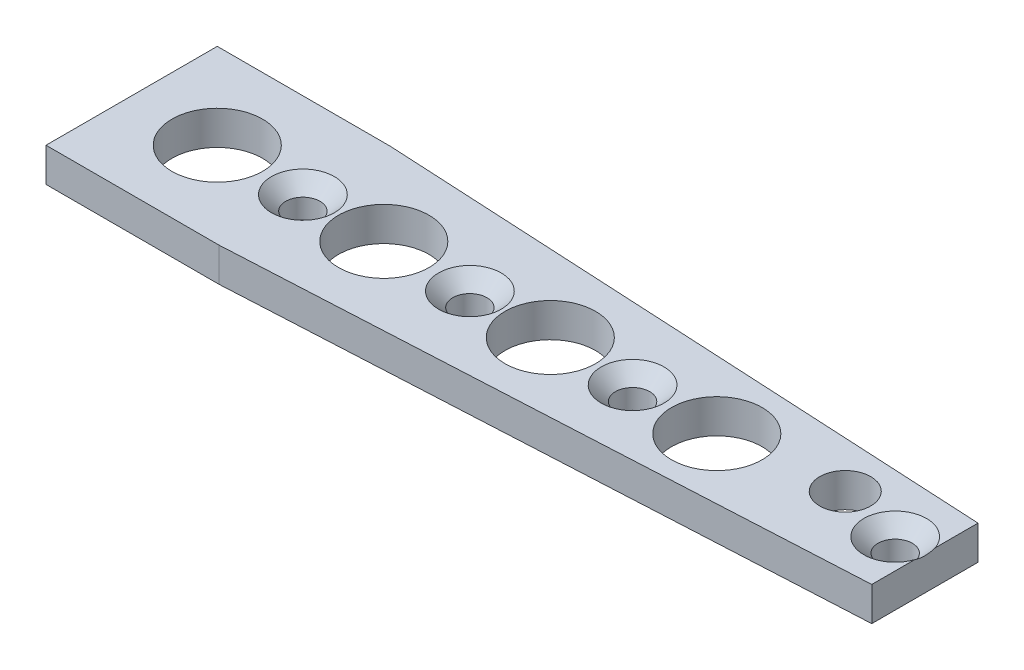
SolidWorks part; units mm, degrees
ref_plane "Front Plane" through (0, 0, 0) normal (0, 0, 1) x (1, 0, 0)
ref_plane "Top Plane" through (0, 0, 0) normal (0, 1, 0) x (1, 0, 0)
ref_plane "Right Plane" through (0, 0, 0) normal (1, 0, 0) x (0, 0, -1)
sketch "Sketch1" plane through (0, 0, 0) normal (0, 1, 0) x (1, 0, 0)
  line L0 (55.58, 3.7222) -> (0, 6.635)
  line L1 (0, 6.635) -> (0, -6.635)
  line L2 (0, -6.635) -> (55.58, -3.7222)
  line L3 (55.58, 3.7222) -> (55.58, -3.7222)
  line L7 (0, -1.309) -> (0, 1.309) construction
  line L8 (-1.309, 0) -> (1.309, 0) construction
  circle A5 centre (12, 0) radius 0.8 construction
  circle A6 centre (23.7, 0) radius 0.8 construction
  circle A7 centre (35.1, 0) radius 0.8 construction
  circle A8 centre (53.5, 0) radius 0.8 construction
  arc A9 (37.8113, 0.796) -> (37.8113, -0.796) centre (37.7313, 0) ccw construction
  point P30 (0, 0)
  point P31 (55.58, 0)
  dimension "D7" = 37.7313
  dimension "D6" = 1.6
  dimension "D2" = 12
  dimension "D3" = 23.7
  dimension "D4" = 35.1
  dimension "D5" = 53.5
  dimension "D9" = 6
  dimension "D10" = 55.58
  dimension "D11" = 13.27
extrude "Boss-Extrude1" add sketch "Sketch1" along normal blind 2.38
hole_wizard "1/4 (0.25) Diameter Hole1" positions "Sketch3" profile "Sketch4" hole size "1/4" standard "ANSI Inch"
sketch "Sketch3" plane through (0, 2.38, 0) normal (0, 1, 0) x (1, 0, 0)
  line L0 (0, -1.309) -> (0, 1.309) construction
  line L1 (-1.309, 0) -> (1.309, 0) construction
  point P0 (6, 0)
  dimension "D1" = 6
sketch "Sketch4" plane through (6, 2.38, 0) normal (1, 0, 0) x (0, 0, 1)
  line L0 (0, 0) -> (0, 2.38)
  line L1 (0, 2.38) -> (3.175, 2.38)
  line L2 (3.175, 2.38) -> (3.175, 0)
  line L5 (3.175, 0) -> (0, 0)
  line L11 (0, -6.35) -> (0, 107.95) construction
  dimension "Thru Hole Dia." = 6.35
  dimension "Thru Hole Depth" = 2.38
pattern_linear "LPattern1" count 4 spacing 11.667 along (1, 0, 0) of "1/4 (0.25) Diameter Hole1"
hole_wizard "9/64 (0.14063) Diameter Hole1" positions "Sketch6" profile "Sketch5" hole size "9/64" standard "ANSI Inch"
sketch "Sketch6" plane through (0, 2.38, 0) normal (0, 1, 0) x (1, 0, 0)
  line L0 (0, -1.309) -> (0, 1.309) construction
  line L1 (-1.309, 0) -> (1.309, 0) construction
  point P0 (49, 1)
  dimension "D1" = 49
  dimension "D2" = 1
sketch "Sketch5" plane through (49, 2.38, -1) normal (1, 0, 0) x (0, 0, 1)
  line L0 (0, 0) -> (0, 2.38)
  line L1 (0, 2.38) -> (1.786, 2.38)
  line L2 (1.786, 2.38) -> (1.786, 0)
  line L5 (1.786, 0) -> (0, 0)
  line L11 (0, -6.35) -> (0, 107.95) construction
  dimension "Thru Hole Dia." = 3.572
  dimension "Thru Hole Depth" = 2.38
hole_wizard "CSK for M2 Flat Head Machine Screw1" positions "Sketch8" profile "Sketch9" countersink size "M2" standard "ANSI Metric"
sketch "Sketch8" plane through (0, 2.38, 0) normal (0, 1, 0) x (1, 0, 0)
  point P0 (12, 0)
  point P3 (23.7, 0)
  point P6 (35.1, 0)
  point P9 (53.5, 0)
sketch "Sketch9" plane through (12, 2.38, 0) normal (1, 0, 0) x (0, 0, 1)
  line L0 (0, 0) -> (0, 2.38)
  line L1 (0, 2.38) -> (1.2, 2.38)
  line L2 (1.2, 2.38) -> (1.2, 1)
  line L3 (1.2, 1) -> (2.2, 0)
  line L5 (2.2, 0) -> (0, 0)
  line L6 (-1.2, 1) -> (-2.2, 0) construction
  line L11 (0, -6.35) -> (0, 107.95) construction
  dimension "Thru Hole Dia." = 2.4
  dimension "Thru Hole Depth" = 2.38
  dimension "Near C'Sink Dia." = 4.4
  dimension "Near C'Sink Angle" = 90
sketch "Sketch13" plane through (0, 2.38, 0) normal (0, 1, 0) x (1, 0, 0)
  line L0 (0, 6) -> (12.1165, 6)
  line L1 (0, 6.635) -> (0, -6.635) construction
  line L2 (55.58, 3.7222) -> (0, 6.635) construction
  line L3 (0, -6) -> (12.1165, -6)
  line L4 (0, -6.635) -> (55.58, -3.7222) construction
  line L5 (12.1165, 6) -> (55.58, 3.7222)
  line L6 (55.58, 3.7222) -> (55.58, -3.7222)
  line L7 (55.58, -3.7222) -> (12.1165, -6)
  line L8 (0, 6) -> (0, -6)
  dimension "D1" = 12
extrude "Cut-Extrude1" cut sketch "Sketch13" against normal through all flip side to cut
